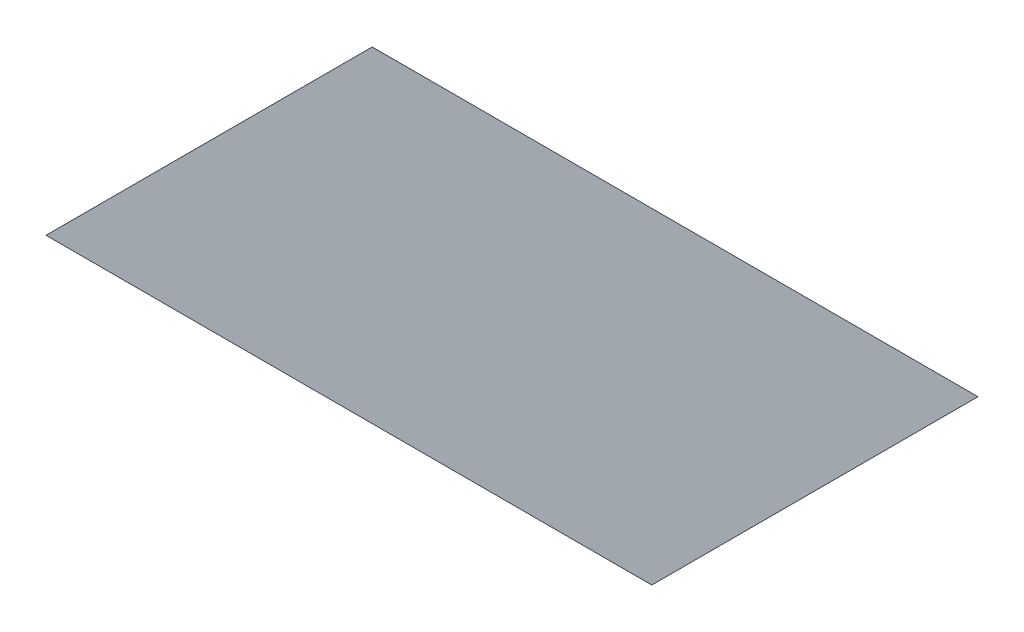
SolidWorks part; units mm, degrees
ref_plane "Ebene vorne" through (0, 0, 0) normal (0, 0, 1) x (1, 0, 0)
ref_plane "Ebene oben" through (0, 0, 0) normal (0, 1, 0) x (1, 0, 0)
ref_plane "Ebene rechts" through (0, 0, 0) normal (1, 0, 0) x (0, 0, -1)
sketch "Skizze1" plane through (0, 0, 0) normal (0, 0, 1) x (1, 0, 0)
  line L0 (0, 0) -> (650, 0)
  line L1 (350, 350) -> (1000, 350)
  line L2 (0, 0) -> (350, 350)
  line L3 (650, 0) -> (1000, 350)
  line L4 (0, 350) -> (650, 350) construction
  line L5 (0, 0) -> (1000, 350) construction
  line L6 (350, 350) -> (650, 0) construction
  line L7 (414.9533, 0) -> (776.5636, 126.5636) construction
  line L8 (223.4364, 223.4364) -> (585.0467, 350) construction
  line L9 (224.1178, 224.1178) -> (416.2187, 0) construction
  line L10 (-45.2844, 129.3841) -> (954.7156, 479.3841) construction
  line L11 (45.2844, -129.3841) -> (1045.2844, 220.6159) construction
  line L12 (583.7813, 350) -> (775.8822, 125.8822) construction
  line L14 (484.768, 465.5155) -> (784.768, 115.5155) construction
  line L15 (215.232, 234.4845) -> (515.232, -115.5155) construction
  dimension "D1" = 650
  dimension "D3" = 45
  dimension "D2" = 350
  dimension "D4" = 137.08
  dimension "D5" = 137.08
  dimension "D6" = 177.5
  dimension "D7" = 177.5
surface "Oberfläche-Ebene2" sketch "Skizze1"
ref_plane "Ebene1" through (0, 0, 0) normal (0.3304, -0.9439, 0) x (0.9439, 0.3304, 0)
sketch3d "3D-Skizze23"
  point P0 (0, 0, 0)
sketch3d "3D-Skizze30"
  line L0 (0, 0, 0) -> (223.4364, 223.4364, 0)
sketch3d "3D-Skizze31"
  line L0 (0, 0, 0) -> (414.9533, 0, 0)
sketch "Skizze3" plane through (0, 0, 0) normal (0.3304, -0.9439, 0) x (0.9439, 0.3304, 0)
  line L1 (529.7405, 30) -> (529.7405, 0) construction
  line L3 (0, 0) -> (1059.481, 0) construction
  arc A1 (0, 0) -> (1059.481, 0) centre (529.7405, -4662.0833) cw
  dimension "D1" = 30
sketch3d "3D-Skizze24"
  line L0 (0, 0, 0) -> (1000, 350, 0) construction
  line L1 (0, 0, 0) -> (1000, 350, 0)
ref_plane "Ebene2" through (374.7059, 321.1765, 0) normal (-0.7593, -0.6508, 0) x (0, 0, 1)
sketch "Skizze4" plane through (374.7059, 321.1765, 0) normal (-0.7593, -0.6508, 0) x (0, 0, 1)
  arc A1 (0, 37.9628) -> (0, -423.0144) centre (-870.4167, -192.5258) cw
sketch3d "3D-Skizze25"
  line L0 (350, 350, 0) -> (650, 0, 0) construction
  line L1 (350, 350, 0) -> (650, 0, 0)
ref_plane "Ebene3" through (45.2844, -129.3841, 0) normal (0.3304, -0.9439, 0) x (0.9439, 0.3304, 0)
sketch "Skizze10" plane through (45.2844, -129.3841, 0) normal (0.3304, -0.9439, 0) x (0.9439, 0.3304, 0)
  line L0 (583.2168, 17.8961) -> (583.2168, -69.22) construction
  arc A0 (391.6571, 0) -> (774.7764, 0) centre (583.2168, -1016.279) cw
  ellipse E0 centre (529.7405, -870.4167) end of major axis (529.7405, -1770.8333) minor radius 327.2422 (613.5079, 0) -> (445.9731, 0) ccw construction
sketch3d "3D-Skizze26"
  line L0 (414.9533, 0, 0) -> (776.5636, 126.5636, 0) construction
  line L1 (414.9533, 0, 0) -> (776.5636, 126.5636, 0)
ref_plane "Ebene4" through (-45.2844, 129.3841, 0) normal (0.3304, -0.9439, 0) x (0.9439, 0.3304, 0)
sketch "Skizze11" plane through (-45.2844, 129.3841, 0) normal (0.3304, -0.9439, 0) x (0.9439, 0.3304, 0)
  line L0 (476.2642, 17.8961) -> (476.2642, -69.5037) construction
  arc A0 (284.7046, 0) -> (667.8239, 0) centre (476.2642, -1016.279) cw
  ellipse E0 centre (529.7405, -870.4167) end of major axis (529.7405, -1770.8333) minor radius 327.2422 (613.5079, 0) -> (445.9731, 0) ccw construction
sketch3d "3D-Skizze27"
  line L0 (223.4364, 223.4364, 0) -> (585.0467, 350, 0) construction
  line L1 (223.4364, 223.4364, 0) -> (585.0467, 350, 0)
ref_plane "Ebene5" through (239.9378, 205.661, 0) normal (-0.7593, -0.6508, 0) x (0, 0, 1)
sketch "Skizze12" plane through (239.9378, 205.661, 0) normal (-0.7593, -0.6508, 0) x (0, 0, 1)
  line L0 (26.1301, -123.2813) -> (0, -123.2813) construction
  arc A0 (0, 24.309) -> (0, -270.8715) centre (-403.7513, -123.2813) cw
  ellipse E0 centre (-4662.0833, -192.5258) end of major axis (30, -192.5258) minor radius 1705.2632 (0, -385.0516) -> (0, 0) ccw construction
sketch3d "3D-Skizze28"
  line L0 (224.1178, 224.1178, 0) -> (416.2187, 0, 0) construction
  line L1 (224.1178, 224.1178, 0) -> (416.2187, 0, 0)
sketch3d "3D-Skizze33"
  arc A0 (0, 0, 0) -> (1000, 350, 0) centre (500, 175, -4662.0833) ccw construction
  arc A1 (0, 0, 0) -> (320.1682, 112.0589, 26.1301) centre (500, 175, -4662.0833) ccw
  point P3 (-1050.0317, 4603.6621, -4662.0833)
  point P4 (-1050.0317, 4603.6621, -4662.0833)
ref_plane "Ebene6" through (509.4739, 436.6919, 0) normal (-0.7593, -0.6508, 0) x (0, 0, 1)
sketch "Skizze13" plane through (509.4739, 436.6919, 0) normal (-0.7593, -0.6508, 0) x (0, 0, 1)
  line L0 (26.1301, -261.7703) -> (0, -261.7703) construction
  arc A0 (0, -114.18) -> (0, -409.3605) centre (-403.7513, -261.7703) cw
  ellipse E0 centre (-4662.0833, -192.5258) end of major axis (30, -192.5258) minor radius 1705.2632 (0, -385.0516) -> (0, 0) ccw construction
sketch3d "3D-Skizze29"
  line L0 (583.7813, 350, 0) -> (775.8822, 125.8822, 0) construction
  line L1 (583.7813, 350, 0) -> (775.8822, 125.8822, 0)
sketch3d "3D-Skizze20"
  line L0 (0, 0, 0) -> (350, 350, 0) construction
  line L1 (224.1178, 224.1178, 0) -> (350, 350, 0)
sketch3d "3D-Skizze21"
  line L0 (0, 0, 0) -> (650, 0, 0) construction
  line L1 (416.2187, 0, 0) -> (650, 0, 0)
sketch3d "3D-Skizze13"
  line L0 (650, 0, 0) -> (1000, 350, 0) construction
  line L1 (650, 0, 0) -> (775.8822, 125.8822, 0)
sketch3d "3D-Skizze12"
  line L0 (350, 350, 0) -> (1000, 350, 0) construction
  line L1 (350, 350, 0) -> (583.7813, 350, 0)
sketch3d "3D-Skizze34"
  point P0 (1000, 350, 0)
sketch3d "3D-Skizze35"
  line L0 (1000, 350, 0) -> (776.5636, 126.5636, 0)
sketch3d "3D-Skizze36"
  line L0 (1000, 350, 0) -> (585.0467, 350, 0)
sketch3d "3D-Skizze37"
  arc A0 (0, 0, 0) -> (1000, 350, 0) centre (500, 175, -4662.0833) ccw construction
  arc A1 (679.8318, 237.9411, 26.1301) -> (1000, 350, 0) centre (500, 175, -4662.0833) ccw
  point P3 (-1050.0317, 4603.6621, -4662.0833)
  point P4 (-1050.0317, 4603.6621, -4662.0833)
sketch3d "3D-Skizze39"
  arc A0 (414.9533, 0, 0) -> (776.5636, 126.5636, 0) centre (595.7585, 63.2818, -1016.279) ccw construction
  arc A1 (414.9533, 0, 0) -> (776.5636, 126.5636, 0) centre (595.7585, 63.2818, -1016.279) ccw
  point P3 (254.1183, 1039.3966, -1016.279)
  point P4 (254.1183, 1039.3966, -1016.279)
sketch3d "3D-Skizze40"
  arc A0 (223.4364, 223.4364, 0) -> (585.0467, 350, 0) centre (404.2415, 286.7182, -1016.279) ccw construction
  arc A1 (223.4364, 223.4364, 0) -> (585.0467, 350, 0) centre (404.2415, 286.7182, -1016.279) ccw
  point P3 (62.6014, 1262.8329, -1016.279)
  point P4 (62.6014, 1262.8329, -1016.279)
sketch3d "3D-Skizze41"
  arc A0 (350, 350, 0) -> (650, 0, 0) centre (500, 175, -870.4167) ccw construction
  arc A1 (404.2415, 286.7182, 17.8961) -> (595.7585, 63.2818, 17.8961) centre (500, 175, -870.4167) ccw
  point P3 (1183.6473, 760.9834, -870.4167)
  point P4 (1183.6473, 760.9834, -870.4167)
sketch3d "3D-Skizze43"
  arc A0 (583.7813, 350, 0) -> (775.8822, 125.8822, 0) centre (679.8318, 237.9411, -403.7513) ccw construction
  arc A1 (583.7813, 350, 0) -> (775.8822, 125.8822, 0) centre (679.8318, 237.9411, -403.7513) ccw
  point P3 (1006.2221, 517.7042, -403.7513)
  point P4 (1006.2221, 517.7042, -403.7513)
sketch3d "3D-Skizze45"
  arc A0 (0, 0, 0) -> (1000, 350, 0) centre (500, 175, -4662.0833) ccw construction
  arc A1 (320.1682, 112.0589, 26.1301) -> (679.8318, 237.9411, 26.1301) centre (500, 175, -4662.0833) ccw
  point P3 (-1050.0317, 4603.6621, -4662.0833)
  point P4 (-1050.0317, 4603.6621, -4662.0833)
sketch3d "3D-Skizze46"
  arc A0 (414.9533, 0, 0) -> (776.5636, 126.5636, 0) centre (595.7585, 63.2818, -1016.279) ccw construction
  arc A1 (414.9533, 0, 0) -> (776.5636, 126.5636, 0) centre (595.7585, 63.2818, -1016.279) ccw
  point P3 (254.1183, 1039.3966, -1016.279)
  point P4 (254.1183, 1039.3966, -1016.279)
sketch3d "3D-Skizze47"
  point P0 (650, 0, 0)
sketch3d "3D-Skizze48"
  line L0 (776.5636, 126.5636, 0) -> (650, 0, 0)
sketch3d "3D-Skizze49"
  line L0 (414.9533, 0, 0) -> (650, 0, 0)
sketch3d "3D-Skizze50"
  arc A0 (350, 350, 0) -> (650, 0, 0) centre (500, 175, -870.4167) ccw construction
  arc A1 (595.7585, 63.2818, 17.8961) -> (650, 0, 0) centre (500, 175, -870.4167) ccw
  point P3 (1183.6473, 760.9834, -870.4167)
  point P4 (1183.6473, 760.9834, -870.4167)
sketch3d "3D-Skizze51"
  arc A0 (223.4364, 223.4364, 0) -> (585.0467, 350, 0) centre (404.2415, 286.7182, -1016.279) ccw construction
  arc A1 (223.4364, 223.4364, 0) -> (585.0467, 350, 0) centre (404.2415, 286.7182, -1016.279) ccw
  point P3 (62.6014, 1262.8329, -1016.279)
  point P4 (62.6014, 1262.8329, -1016.279)
sketch3d "3D-Skizze52"
  point P0 (350, 350, 0)
sketch3d "3D-Skizze53"
  line L0 (585.0467, 350, 0) -> (350, 350, 0)
sketch3d "3D-Skizze54"
  line L0 (223.4364, 223.4364, 0) -> (350, 350, 0)
sketch3d "3D-Skizze55"
  arc A0 (350, 350, 0) -> (650, 0, 0) centre (500, 175, -870.4167) ccw construction
  arc A1 (350, 350, 0) -> (404.2415, 286.7182, 17.8961) centre (500, 175, -870.4167) ccw
  point P3 (1183.6473, 760.9834, -870.4167)
  point P4 (1183.6473, 760.9834, -870.4167)
sketch "Skizze16" [suppressed] plane through (0, 0, 0) normal (0, 0, -1) x (-1, 0, 0)
  line L8 (-584.414, 360.01) -> (-1024.1663, 360.01)
  line L9 (-1024.1663, 360.01) -> (-783.3011, 119.1448)
  line L10 (-783.3011, 119.1448) -> (-654.1463, -10.01)
  line L11 (-654.1463, -10.01) -> (-415.586, -10.01)
  line L12 (-415.586, -10.01) -> (24.1663, -10.01)
  line L13 (24.1663, -10.01) -> (-216.6989, 230.8552)
  line L14 (-216.6989, 230.8552) -> (-345.8537, 360.01)
  line L15 (-345.8537, 360.01) -> (-584.414, 360.01)
sketch3d "3D-Skizze56"
  arc A0 (350, 350, 0) -> (650, 0, 0) centre (500, 175, -870.4167) ccw construction
  arc A1 (404.2415, 286.7182, 17.8961) -> (595.7585, 63.2818, 17.8961) centre (500, 175, -870.4167) ccw
  point P3 (1183.6473, 760.9834, -870.4167)
  point P4 (1183.6473, 760.9834, -870.4167)
